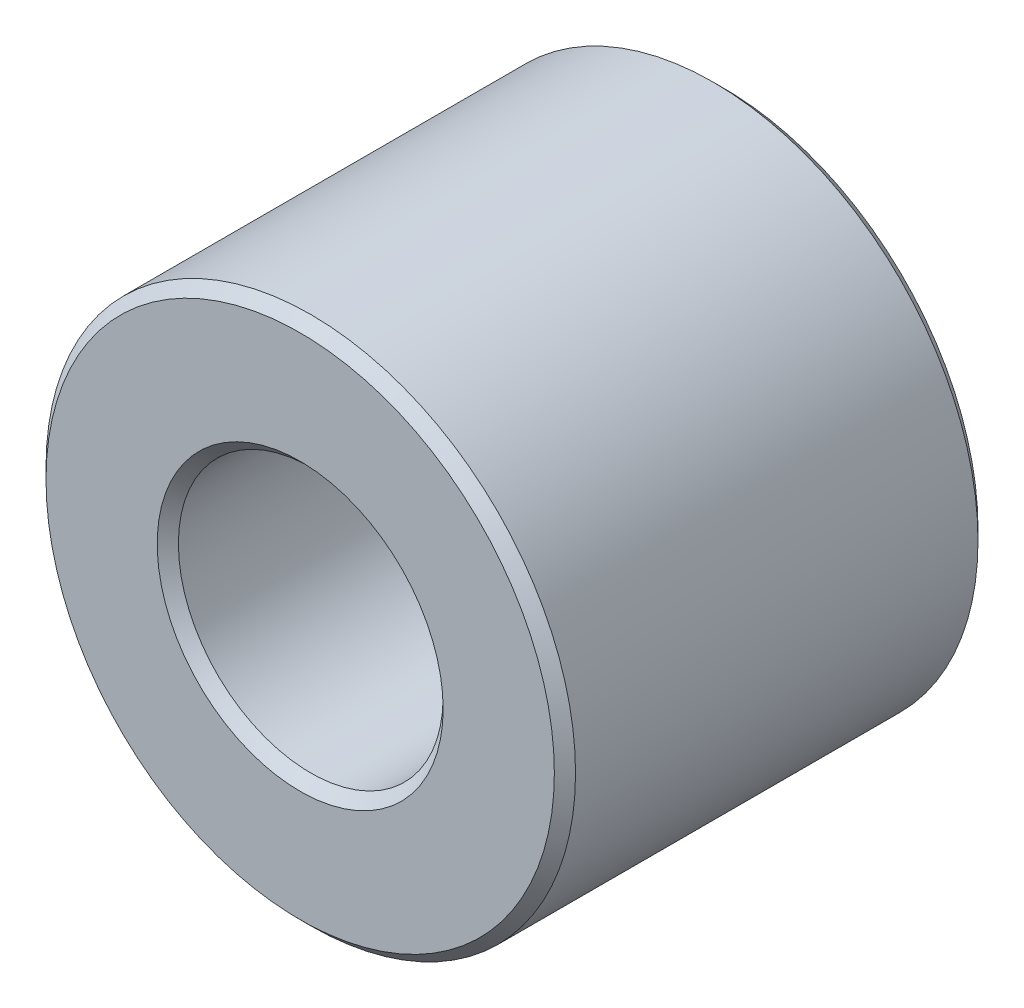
SolidWorks part; units mm, degrees
ref_plane "Front Plane" through (0, 0, 0) normal (0, 0, 1) x (1, 0, 0)
ref_plane "Top Plane" through (0, 0, 0) normal (0, 1, 0) x (1, 0, 0)
ref_plane "Right Plane" through (0, 0, 0) normal (1, 0, 0) x (0, 0, -1)
sketch "Sketch1" plane through (0, 0, 0) normal (0, 0, 1) x (1, 0, 0)
  circle A0 centre (0, 0) radius 2.5
  circle A1 centre (0, 0) radius 1.25
  dimension "D1" = 5
  dimension "D2" = 2.5
extrude "Boss-Extrude2" add sketch "Sketch1" along normal mid plane 4
chamfer "Chamfer3" distance 0.1 angle 45 4 edges at (2.5, 0, 2) (2.5, 0, -2) (1.25, 0, -2) (1.25, 0, 2)
